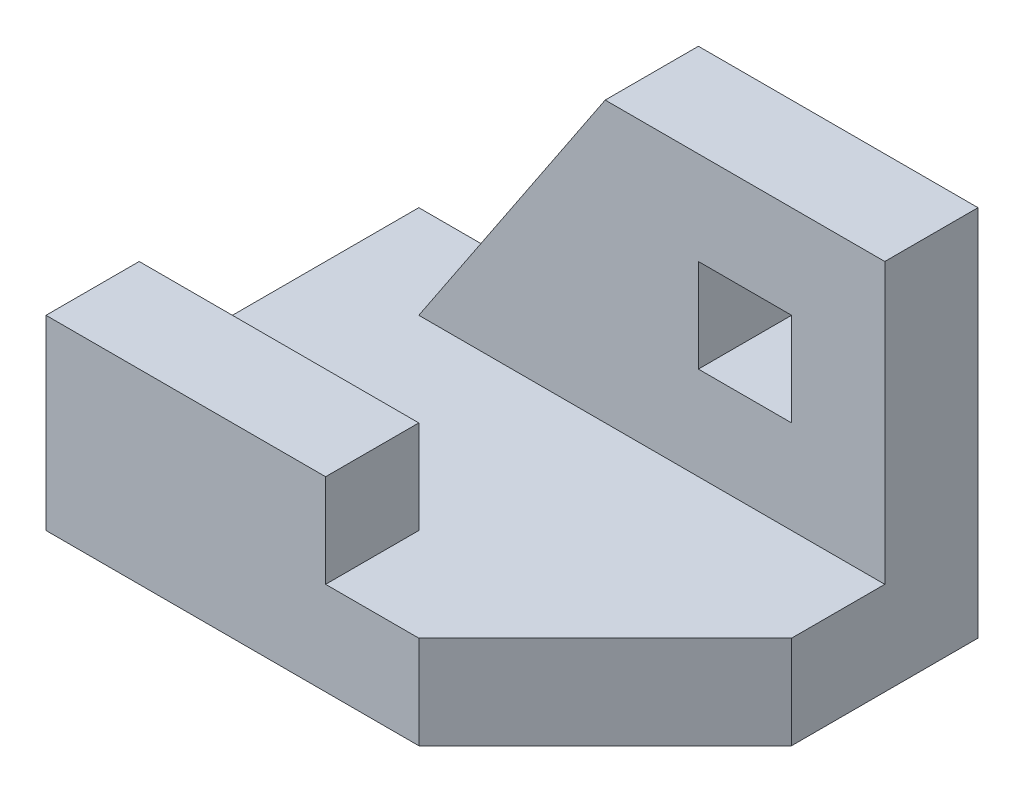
SolidWorks part; units mm, degrees
ref_plane "Front Plane" through (0, 0, 0) normal (0, 0, 1) x (1, 0, 0)
ref_plane "Top Plane" through (0, 0, 0) normal (0, 1, 0) x (1, 0, 0)
ref_plane "Right Plane" through (0, 0, 0) normal (1, 0, 0) x (0, 0, -1)
sketch "Sketch1" plane through (0, 0, 0) normal (0, 1, 0) x (1, 0, 0)
  line L0 (-30, 20) -> (30, -20) construction
  line L1 (-30, -20) -> (30, -20)
  line L2 (-30, -20) -> (-30, 20)
  line L3 (-30, 20) -> (30, 20)
  line L4 (30, -20) -> (30, 20)
  dimension "D1" = 40
  dimension "D2" = 60
extrude "Extrude1" add sketch "Sketch1" along normal blind 10
chamfer "Chamfer1" distance 20 angle 45 1 edges at (30, 5, 20)
sketch "Sketch2" plane through (0, 10, 0) normal (0, 1, 0) x (1, 0, 0)
  line L1 (-30, -20) -> (0, -20)
  line L2 (-30, -20) -> (-30, -10)
  line L3 (-30, -10) -> (0, -10)
  line L4 (0, -20) -> (0, -10)
  dimension "D1" = 30
  dimension "D2" = 10
extrude "Extrude2" add sketch "Sketch2" along normal blind 10
sketch "Sketch3" plane through (0, 0, -20) normal (0, 0, -1) x (-1, 0, 0)
  line L0 (-30, 10) -> (-30, 40)
  line L1 (-30, 40) -> (0, 40)
  line L2 (0, 40) -> (20, 10)
  line L3 (-30, 10) -> (30, 10) construction
  line L4 (20, 10) -> (-30, 10)
  line L6 (-20, 30) -> (-10, 30)
  line L7 (-20, 30) -> (-20, 20)
  line L8 (-20, 20) -> (-10, 20)
  line L9 (-10, 30) -> (-10, 20)
  dimension "D1" = 30
  dimension "D2" = 30
  dimension "D3" = 50
  dimension "D4" = 10
  dimension "D5" = 10
  dimension "D6" = 10
extrude "Extrude3" add sketch "Sketch3" against normal blind 10
